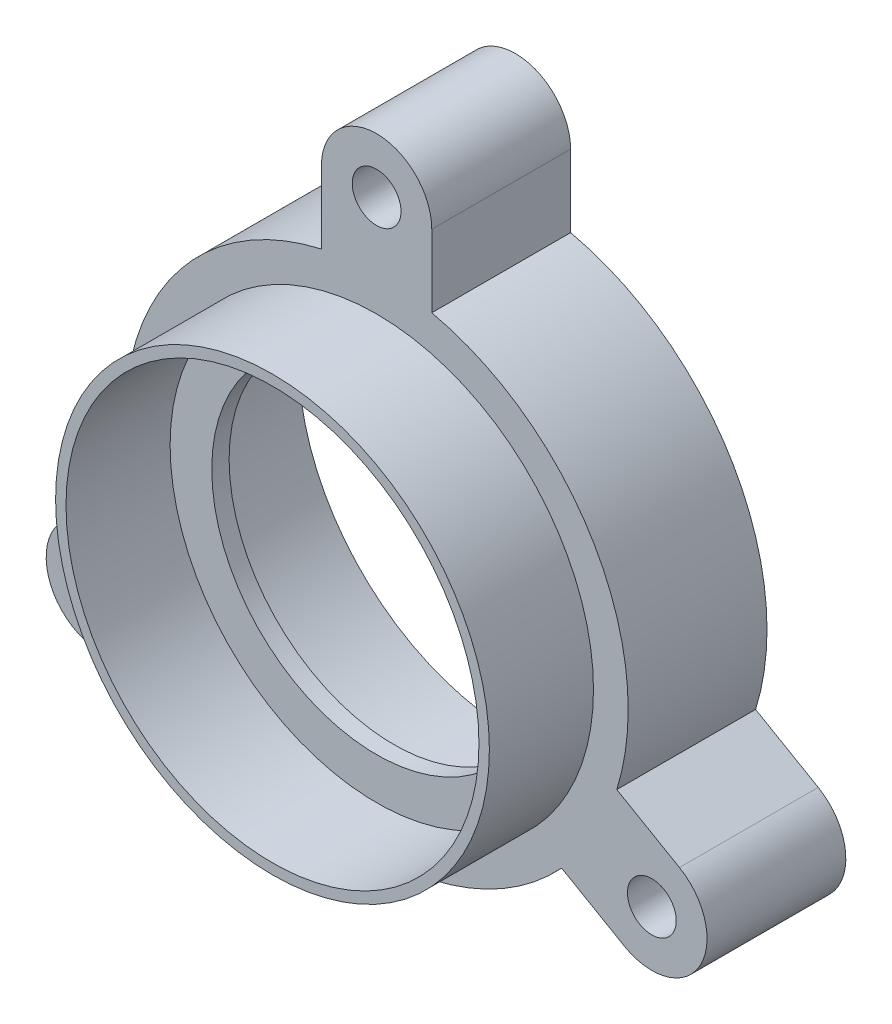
SolidWorks part; units mm, degrees
ref_plane "Front" through (0, 0, 0) normal (0, 0, 1) x (1, 0, 0)
ref_plane "Top" through (0, 0, 0) normal (0, 1, 0) x (1, 0, 0)
ref_plane "Right" through (0, 0, 0) normal (1, 0, 0) x (0, 0, -1)
sketch "Sketch1" plane through (0, 0, 0) normal (0, 0, 1) x (1, 0, 0)
  circle A0 centre (0, 0) radius 12.5
  circle A1 centre (0, 0) radius 14.5
extrude "Base-Extrude" add sketch "Sketch1" along normal blind 8
sketch "Sketch5" plane through (0, 0, 8) normal (0, 0, 1) x (1, 0, 0)
  line L0 (3.18, 14.147) -> (3.18, 18.317)
  line L1 (-3.18, 14.147) -> (-3.18, 18.317)
  line L2 (0, 0) -> (0, 32.9892) construction
  line L3 (0, 0) -> (27.8987, 16.1073) construction
  line L4 (13.8417, -4.3195) -> (17.453, -6.4045)
  line L5 (10.6617, -9.8275) -> (14.273, -11.9125)
  line L6 (-10.6617, -9.8275) -> (-14.273, -11.9125)
  line L7 (-13.8417, -4.3195) -> (-17.453, -6.4045)
  circle A0 centre (0, 0) radius 14.5 construction
  arc A1 (-3.18, 18.317) -> (3.18, 18.317) centre (0, 18.317) cw
  circle A2 centre (0, 18.317) radius 1.405
  arc A3 (3.18, 14.147) -> (-3.18, 14.147) centre (0, 0) ccw
  arc A4 (14.273, -11.9125) -> (17.453, -6.4045) centre (15.863, -9.1585) ccw
  arc A5 (13.8417, -4.3195) -> (10.6617, -9.8275) centre (0, 0) cw
  circle A6 centre (15.863, -9.1585) radius 1.405
  arc A7 (-13.8417, -4.3195) -> (-10.6617, -9.8275) centre (0, 0) ccw
  arc A8 (-14.273, -11.9125) -> (-17.453, -6.4045) centre (-15.863, -9.1585) cw
  circle A9 centre (-15.863, -9.1585) radius 1.405
  dimension "D2" = 3.18
  dimension "D3" = 60
  dimension "D4" = 2.81
  dimension "D1" = 4.17
sketch "Sketch7" plane through (0, 0, 8) normal (0, 0, 1) x (1, 0, 0)
  circle A0 centre (0, 0) radius 9.5
  circle A1 centre (0, 0) radius 12.5
extrude "Boss-Extrude2" add sketch "Sketch7" against normal blind 1
sketch "Sketch8" plane through (0, 0, 8) normal (0, 0, 1) x (1, 0, 0)
  circle A0 centre (0, 0) radius 11.9
  circle A1 centre (0, 0) radius 12.5
extrude "Boss-Extrude6" add sketch "Sketch8" along normal blind 6
extrude "Boss-Extrude7" add sketch "Sketch5" against normal blind 8
